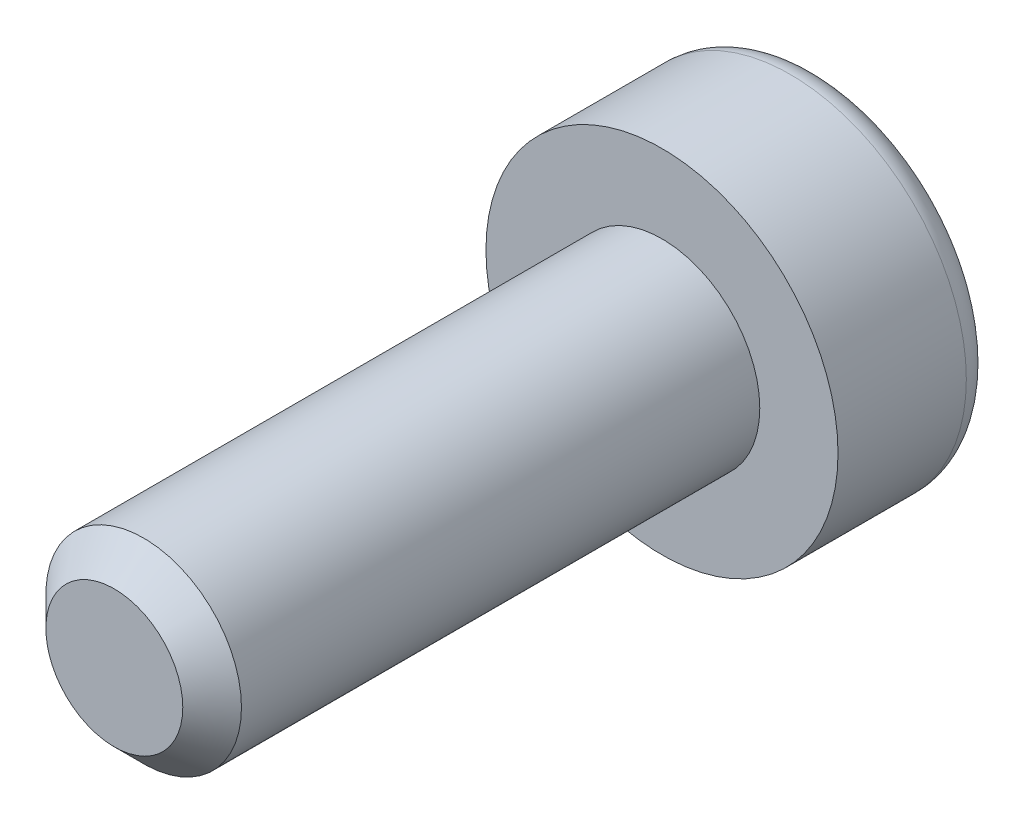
SolidWorks part; units mm, degrees
ref_plane "Plan1" through (0, 0, 0) normal (0, 0, 1) x (1, 0, 0)
ref_plane "Plan2" through (0, 0, 0) normal (0, 1, 0) x (1, 0, 0)
ref_plane "Plan3" through (0, 0, 0) normal (1, 0, 0) x (0, 0, -1)
sketch "Esquisse1" plane through (0, 0, 0) normal (0, 0, 1) x (1, 0, 0)
  circle A0 centre (0, 0) radius 5
  dimension "D" = 10
extrude "Corps" add sketch "Esquisse1" along normal blind 28
sketch "Esquisse2" plane through (0, 0, 0) normal (0, 0, 1) x (1, 0, 0)
  circle A0 centre (0, 0) radius 9
  dimension "D1" = 18
extrude "Tete" add sketch "Esquisse2" against normal blind 8
ref_plane "Plan4" through (0, 0, -8) normal (0, 0, 1) x (1, 0, 0)
sketch "Esquisse3" plane through (0, 0, -8) normal (0, 0, 1) x (1, 0, 0)
  line L1 (0, -3.4641) -> (3, -1.7321)
  line L2 (3, -1.7321) -> (3, 1.7321)
  line L3 (3, 1.7321) -> (0, 3.4641)
  line L4 (0, 3.4641) -> (-3, 1.7321)
  line L5 (-3, 1.7321) -> (-3, -1.7321)
  line L6 (-3, -1.7321) -> (0, -3.4641)
  circle A0 centre (0, 0) radius 3 construction
  dimension "D1" = 6
extrude "6pans" cut sketch "Esquisse3" along normal blind 5.6
chamfer "Chanfrein2" distance 1.5 angle 45 1 edges at (5, 0, 28)
fillet "Congé1" radius 1.44 1 edges at (9, 0, -8)
equation "\"D1@Congé1\"=\"D1@Esquisse2\"*0.08"
equation "\"D1@Chanfrein2\"=\"D@Esquisse1\"*0.15"
equation "\"HT@6pans\"=\"HT@Tete\"*0.7"
equation "\"D1@Plan4\" = \"HT@Tete\""
